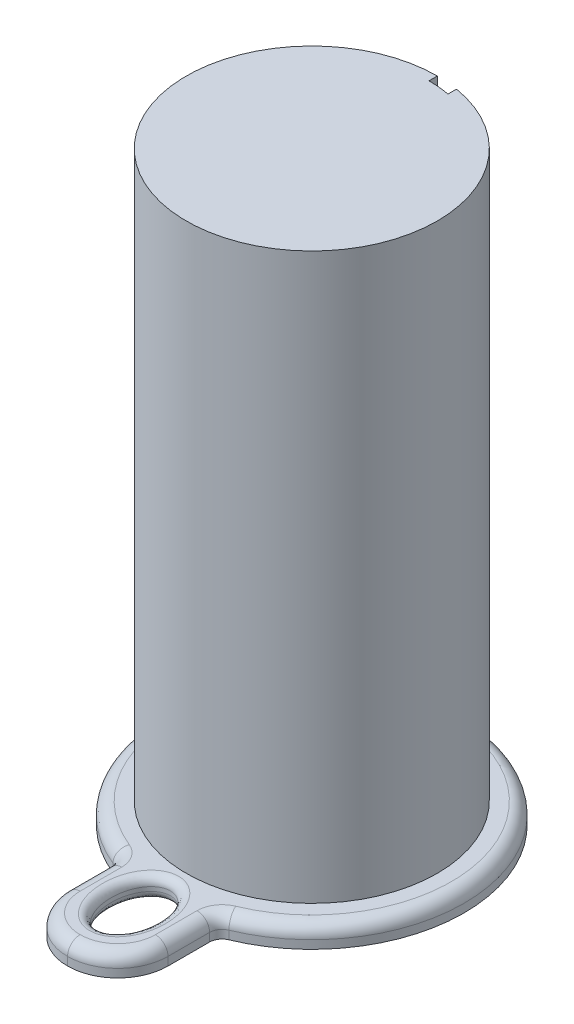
SolidWorks part; units mm, degrees
ref_plane "Front Plane" through (0, 0, 0) normal (0, 0, 1) x (1, 0, 0)
ref_plane "Top Plane" through (0, 0, 0) normal (0, 1, 0) x (1, 0, 0)
ref_plane "Right Plane" through (0, 0, 0) normal (1, 0, 0) x (0, 0, -1)
sketch "Sketch1" plane through (0, 0, 0) normal (0, 1, 0) x (1, 0, 0)
  circle A0 centre (0, 0) radius 38.1
extrude "Boss-Extrude1" add sketch "Sketch1" along normal blind 177.8
sketch "Sketch4" plane through (0, 0, 0) normal (0, 1, 0) x (1, 0, 0)
  line L2 (-15.24, -43.6308) -> (-15.24, -74.1108)
  line L3 (-15.24, -74.1108) -> (15.24, -74.1108)
  line L4 (15.24, -43.6308) -> (15.24, -74.1108)
  arc A0 (15.24, -43.6308) -> (-15.24, -43.6308) centre (0, 0) ccw
extrude "Boss-Extrude2" add sketch "Sketch4" along normal blind 6.35
sketch "Sketch3" plane through (0, 0, 0) normal (0, -1, 0) x (1, 0, 0)
  circle A0 centre (0, 0) radius 33.02
extrude "Cut-Extrude1" cut sketch "Sketch3" against normal blind 172.72
fillet "Fillet1" radius 3.81 7 edges at (0, 6.35, -46.2159) (15.24, 3.175, 43.6308) (0, 6.35, 74.1108) (15.24, 6.35, 58.8708) (-15.24, 3.175, 43.6308) (-15.24, 6.35, 58.8708) (0, 0, -33.02)
fillet "Fillet3" radius 15.24 4 edges at (-14.1241, 5.2341, 72.9949) (14.1241, 5.2341, 72.9949) (15.24, 1.27, 74.1108) (-15.24, 1.27, 74.1108)
sketch "Sketch5" plane through (0, 6.35, 0) normal (0, 1, 0) x (1, 0, 0)
  ellipse E0 centre (0, -53.9101) end of major axis (0.6734, -65.2581) minor radius 7.5164
extrude "Cut-Extrude2" cut sketch "Sketch5" against normal through all
fillet "Fillet4" radius 2.54 2 edges at (0.6734, 6.35, 65.2581) (0.6734, 0, 65.2581)
ref_plane "Plane1" through (0, 0, -38.1) normal (0, 0, -1) x (-1, 0, 0)
sketch "Sketch6" plane through (0, 0, -38.1) normal (0, 0, -1) x (-1, 0, 0)
  line L0 (38.1, 6.35) -> (-38.1, 6.35) construction
  line L9 (0, 6.35) -> (-6.35, 6.35)
  line L10 (0, 6.35) -> (0, 31.75)
  line L11 (0, 31.75) -> (-6.35, 31.75)
  line L12 (-6.35, 6.35) -> (-6.35, 31.75)
  point P4 (0, 0)
  point P7 (0, 0)
  point P8 (0, 0)
  point P9 (0, 0)
  point P10 (0, 0)
  point P13 (0, 0)
extrude "Cut-Extrude3" cut sketch "Sketch6" against normal offset from surface (3.1116 mm away) 2.54
pattern_linear "LPattern2" count 7 spacing 25.4 along (0, 1, 0) of "Cut-Extrude3"
